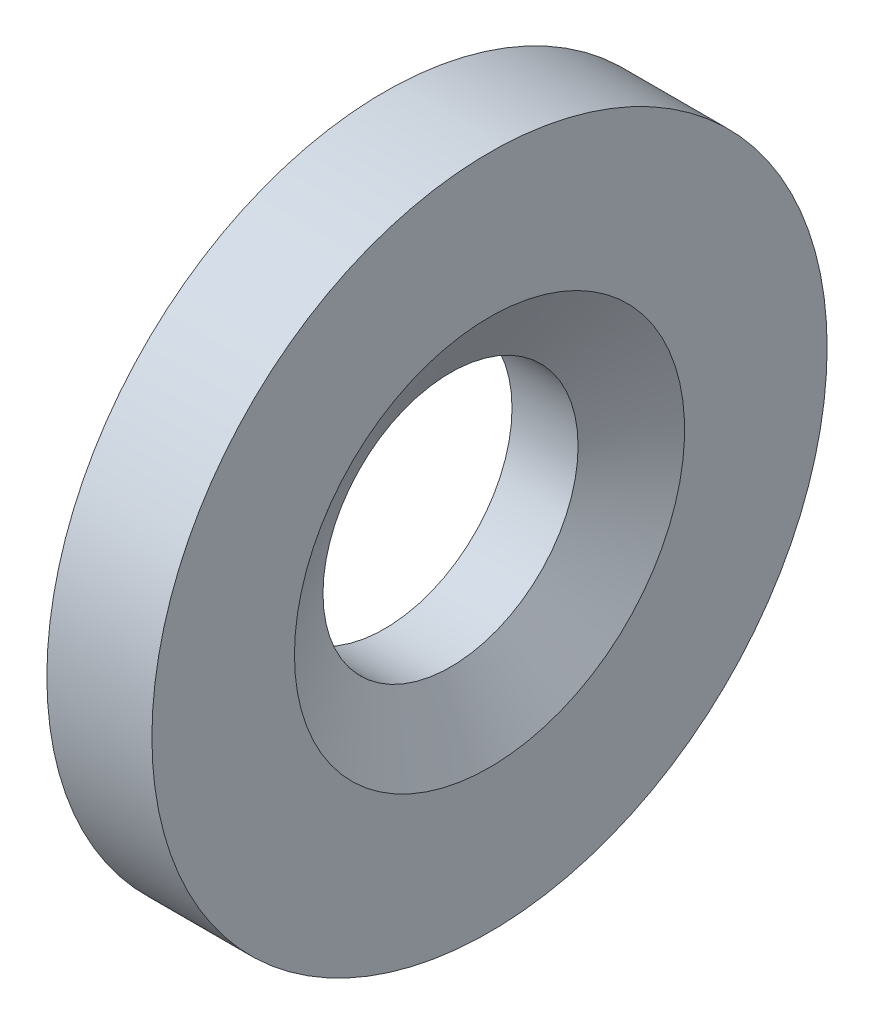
SolidWorks part; units mm, degrees
ref_plane "Plan de face" through (0, 0, 0) normal (0, 0, 1) x (1, 0, 0)
ref_plane "Plan de dessus" through (0, 0, 0) normal (0, 1, 0) x (1, 0, 0)
ref_plane "Plan de droite" through (0, 0, 0) normal (1, 0, 0) x (0, 0, -1)
sketch "Esquisse1" plane through (0, 0, 0) normal (0, 0, 1) x (1, 0, 0)
  line L0 (-23.5479, 0) -> (36.7727, 0) construction
  line L1 (0, 8.5) -> (0, 22.5)
  line L2 (0, 22.5) -> (7, 22.5)
  line L3 (7, 22.5) -> (7, 13)
  line L4 (7, 13) -> (4.4019, 8.5)
  line L5 (4.4019, 8.5) -> (0, 8.5)
  dimension "D1" = 17
  dimension "D2" = 45
  dimension "D3" = 7
  dimension "D4" = 60
  dimension "D5" = 26
revolve "Révolution1" add sketch "Esquisse1" angle 360 about L0
